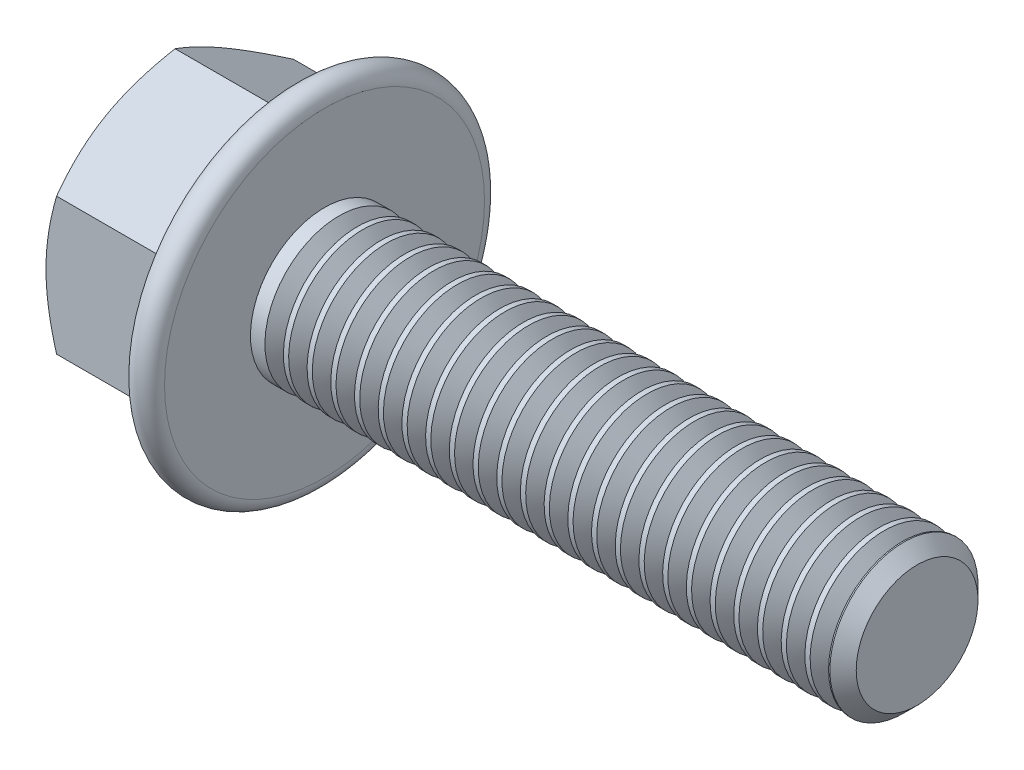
SolidWorks part; units mm, degrees
extrude "BaseHead" add sketch "Sketch1" along normal blind 5.4
sketch "Sketch1" plane through (0, 0, 0) normal (1, 0, 0) x (0, 0, -1)
  line L0 (4, 2.3094) -> (4, -2.3094)
  line L1 (-4, 2.3094) -> (-4, -2.3094)
  line L2 (4, -2.3094) -> (0, -4.6188)
  line L3 (0, -4.6188) -> (-4, -2.3094)
  line L4 (4, 2.3094) -> (0, 4.6188)
  line L5 (0, 4.6188) -> (-4, 2.3094)
ref_plane "Plane1" through (0, 0, 0) normal (0, 0, 1) x (1, 0, 0)
ref_plane "Plane2" through (0, 0, 0) normal (0, 1, 0) x (1, 0, 0)
ref_plane "Plane3" through (0, 0, 0) normal (1, 0, 0) x (0, 0, -1)
sketch "BodySke" plane through (0, 0, 0) normal (0, 0, 1) x (1, 0, 0)
  line L0 (0, 2.3094) -> (0, -2.3094) construction
  line L1 (0, 0) -> (25.4, 0)
  line L2 (0, 0) -> (0, 2.5)
  line L3 (0, 2.5) -> (24.955, 2.5)
  line L4 (25.4, 0) -> (25.4, 2.055)
  line L5 (5.4, 4.6188) -> (5.4, 2.3094) construction
  line L6 (25.4, 2.055) -> (24.955, 2.5)
  line L7 (0, 0) -> (96.52, 0) construction
  line L8 (25.4, -2.055) -> (24.955, -2.5) construction
  line L9 (0, -2.5) -> (24.955, -2.5) construction
  line L10 (6.2, 15.24) -> (6.2, -1.27) construction
  line L11 (5.4, 15.24) -> (5.4, -1.27) construction
  line L12 (5.4, 2.3094) -> (5.4, -2.3094) construction
revolve "BaseBody" add sketch "BodySke"
fillet "HeadFillet" [suppressed] radius 0.25
sketch "Sketch3" plane through (0, 0, 0) normal (0, 0, 1) x (1, 0, 0)
  line L0 (0, 4) -> (3.244, 9.6188)
  line L1 (0, 4.6188) -> (0, 2.3094) construction
  line L2 (3.244, 9.6188) -> (3.244, 14.6188)
  line L3 (3.244, 14.6188) -> (-10, 14.6188)
  line L4 (-10, 14.6188) -> (-10, 4)
  line L5 (-10, 4) -> (0, 4)
  line L6 (0, 0) -> (99.06, 0) construction
  line L7 (5.4, 4.6188) -> (0, 4.6188) construction
revolve "HeadChamfer" cut sketch "Sketch3" angle 360 about L6
sketch "Sketch4" plane through (0, 0, 0) normal (0, 0, 1) x (1, 0, 0)
  line L0 (2.4025, 0) -> (4.4302, 5.571)
  line L1 (5.4, 4.6188) -> (5.4, 2.3094) construction
  line L2 (4.4, 34.3444) -> (4.4, 16.9779) construction
  line L3 (5.4, 0) -> (5.4, 5.4)
  line L4 (8.3021, 5.9) -> (20.1618, 5.9) construction
  line L5 (0, 0) -> (95.25, 0) construction
  line L6 (0, 0) -> (96.52, 0) construction
  line L7 (2.4025, 0) -> (5.4, 0)
  line L8 (8.3021, -5.9) -> (20.1618, -5.9) construction
  arc A0 (5.4, 5.4) -> (4.4302, 5.571) centre (4.9, 5.4) ccw
  dimension "D1" = 20
  dimension "Flange_thickness" = 1
  dimension "Flange_dia" = 11.8
revolve "Flange" add sketch "Sketch4" angle 360 about L5
fillet "FlangeHexFillet" radius 0.3 6 edges
sketch "ThdSchSke" plane through (0, 0, 0) normal (0, 0, 1) x (1, 0, 0)
  line L0 (6.2, -2.055) -> (5.8884, -2.5)
  line L1 (6.2, -2.055) -> (6.5116, -2.5)
  line L2 (6.5116, -2.5) -> (6.5116, -3.125)
  line L3 (-3.175, 0) -> (5.1513, 0) construction
  line L5 (6.5116, -3.125) -> (5.8884, -3.125)
  line L6 (5.8884, -3.125) -> (5.8884, -2.5)
revolve "ThreadSchematic" cut sketch "ThdSchSke" angle 360 about L3
pattern_linear "ThdSchPat" count 24 spacing 0.8 along (1, 0, 0) of "ThreadSchematic"
equation "\"D3@Sketch1\" = \"Width_flats@Sketch1\" / 2"
equation "\"D4@Sketch1\" = \"D3@Sketch1\""
equation "\"D5@Sketch1\" = \"D4@Sketch1\""
equation "\"Thread_minor@ThreadCosmetic\" = \"Minor_dia@BodySke\""
equation "\"D1@Sketch3\" = \"Width_flats@Sketch1\" / 2"
equation "\"Thread_length@ThreadCosmetic\" = ((sgn( (\"Length@BodySke\" - \"Advance@BodySke\" ) - \"Thread_nom@BodySke\" )-1)*( (\"Length@BodySke\" - \"Advance@BodySke\" ) - \"Thread_nom@BodySke\" ))/-2+ \"Thread_nom@BodySke\""
equation "\"Thread_minor@ThdSchSke\" = \"Minor_dia@BodySke\""
equation "\"Diameter@ThdSchSke\" = \"Diameter@BodySke\""
equation "\"Overcut@ThdSchSke\" = \"Diameter@BodySke\" * 1.25"
equation "\"Start@ThdSchSke\" = \"Head_ht@BaseHead\" + \"Length@BodySke\" - \"Thread_length@ThreadCosmetic\"  '---Non-countersunk---"
equation "\"Num_threads@ThdSchPat\" = int( \"Thread_length@ThreadCosmetic\" / \"Advance@BodySke\" + 0.999 )  + 1"
equation "\"Advance@ThdSchPat\" = \"Thread_length@ThreadCosmetic\" /  (\"Num_threads@ThdSchPat\" - 1) 'relax it"
equation "\"Num_threads@ThdSchPat\" = \"Num_threads@ThdSchPat\" - sgn( \"Num_threads@ThdSchPat\" - 1) '---chamfered tips only---"
